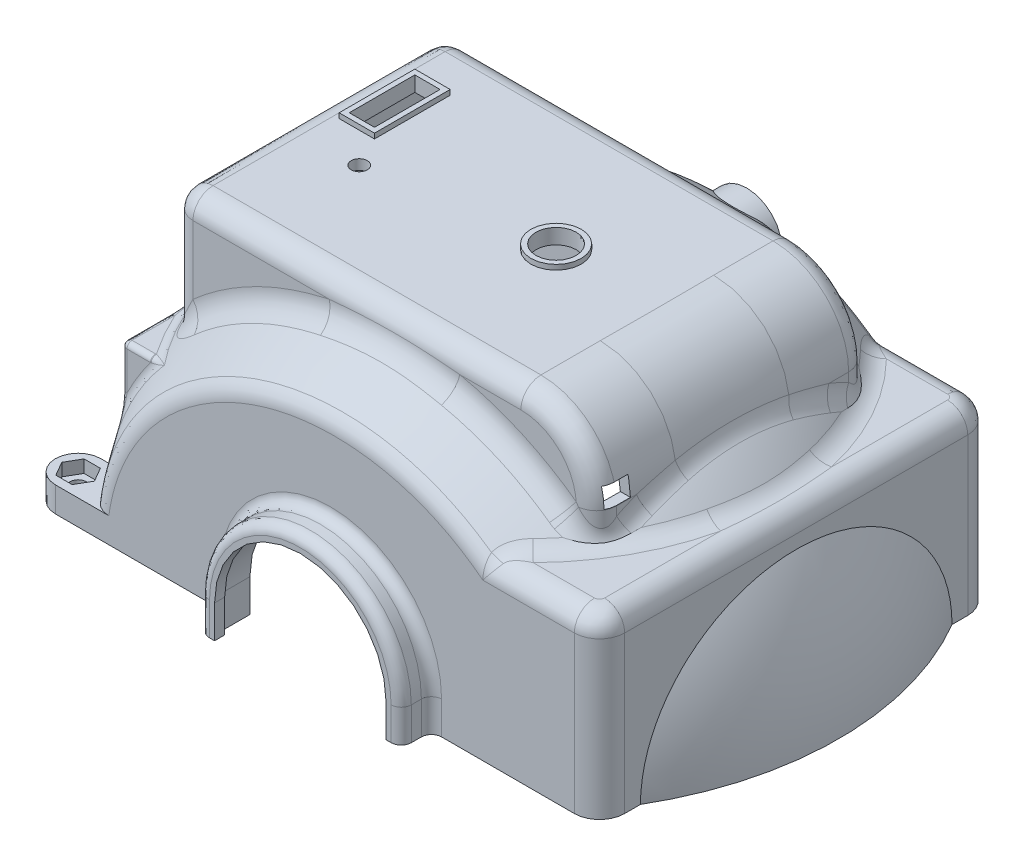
SolidWorks part; units mm, degrees
ref_plane "Plan de face" through (0, 0, 0) normal (0, 0, 1) x (1, 0, 0)
ref_plane "Plan de dessus" through (0, 0, 0) normal (0, 1, 0) x (1, 0, 0)
ref_plane "Plan de droite" through (0, 0, 0) normal (1, 0, 0) x (0, 0, -1)
sketch "Base" plane through (0, 0, 0) normal (0, 1, 0) x (1, 0, 0)
  line L0 (-52.1999, -39) -> (-25.6999, -39) construction
  line L1 (68.8001, 0) -> (-73.5868, 0) construction
  line L2 (-56.0925, -28.4341) -> (-46.1999, -20) construction
  line L3 (-19.6999, -33) -> (-19.6999, -29) construction
  line L4 (-19.6999, -29) -> (-13.8999, -29) construction
  line L5 (-9.8999, -25) -> (-9.8999, -24.5) construction
  line L6 (-9.8999, -24.5) -> (24.1001, -24.5) construction
  line L7 (24.1001, -24.5) -> (24.1001, -25) construction
  line L8 (28.1001, -29) -> (33.9001, -29) construction
  line L9 (33.9001, -29) -> (33.9001, -34) construction
  line L10 (38.9001, -39) -> (55.4001, -39) construction
  line L11 (60.4001, -34) -> (60.4001, -13.75) construction
  line L12 (57.9001, -11.25) -> (57.4001, -11.25) construction
  line L13 (57.9001, 11.25) -> (57.4001, 11.25) construction
  line L14 (60.4001, 34) -> (60.4001, 13.75) construction
  line L15 (38.9001, 39) -> (55.4001, 39) construction
  line L16 (33.9001, 29) -> (33.9001, 34) construction
  line L17 (28.1001, 29) -> (33.9001, 29) construction
  line L18 (24.1001, 24.5) -> (24.1001, 25) construction
  line L19 (-9.8999, 24.5) -> (24.1001, 24.5) construction
  line L20 (-9.8999, 25) -> (-9.8999, 24.5) construction
  line L21 (-19.6999, 29) -> (-13.8999, 29) construction
  line L22 (-19.6999, 33) -> (-19.6999, 29) construction
  line L23 (-56.0925, 28.4341) -> (-46.1999, 20) construction
  line L24 (-52.1999, 39) -> (-25.6999, 39) construction
  line L25 (57.4001, -11.25) -> (57.4001, 11.25) construction
  line L26 (-46.1999, -20) -> (-46.1999, 20) construction
  line L27 (57.4001, -66.5167) -> (57.4001, 25) construction
  line L28 (-46.1999, -66.5167) -> (-46.1999, 22.9924) construction
  line L29 (7.8001, -55.2275) -> (7.8001, 8.1549) construction
  line L30 (85.3932, 29) -> (-66.316, 29) construction
  line L31 (85.3932, -29) -> (-62.5031, -29) construction
  line L32 (39.9001, -34.5) -> (54.4001, -34.5) construction
  line L33 (-47.4499, -34.5) -> (-8.4415, -34.5) construction
  line L34 (-47.4499, 34.5) -> (-5.5388, 34.5) construction
  line L35 (-25.6999, -35.6222) -> (-25.6999, 43.8871) construction
  arc A0 (-56.0925, -28.4341) -> (-52.1999, -39) centre (-52.1999, -33) ccw construction
  arc A1 (60.4001, 13.75) -> (57.9001, 11.25) centre (57.9001, 13.75) cw construction
  arc A2 (-25.6999, -39) -> (-19.6999, -33) centre (-25.6999, -33) ccw construction
  arc A3 (-13.8999, -29) -> (-9.8999, -25) centre (-13.8999, -25) ccw construction
  arc A4 (24.1001, -25) -> (28.1001, -29) centre (28.1001, -25) ccw construction
  arc A5 (33.9001, -34) -> (38.9001, -39) centre (38.9001, -34) ccw construction
  arc A6 (55.4001, -39) -> (60.4001, -34) centre (55.4001, -34) ccw construction
  arc A7 (60.4001, -13.75) -> (57.9001, -11.25) centre (57.9001, -13.75) ccw construction
  arc A8 (38.9001, -39) -> (33.9001, -34) centre (38.9001, -34) cw construction
  arc A9 (55.4001, 39) -> (60.4001, 34) centre (55.4001, 34) cw construction
  arc A10 (24.1001, 25) -> (28.1001, 29) centre (28.1001, 25) cw construction
  arc A11 (-13.8999, 29) -> (-9.8999, 25) centre (-13.8999, 25) cw construction
  arc A12 (-25.6999, 39) -> (-19.6999, 33) centre (-25.6999, 33) cw construction
  arc A13 (-56.0925, 28.4341) -> (-52.1999, 39) centre (-52.1999, 33) cw construction
  circle A14 centre (-47.4499, -34.5) radius 1.6 construction
  circle A15 centre (-40.1999, -34.5) radius 1.6 construction
  circle A16 centre (-32.9499, -34.5) radius 1.6 construction
  circle A17 centre (-25.6999, -34.5) radius 1.6 construction
  circle A18 centre (-52.4499, -29.25) radius 1.6 construction
  circle A19 centre (-47.9499, -25.5) radius 1.6 construction
  circle A20 centre (39.9001, -34.5) radius 1.6 construction
  circle A21 centre (47.1501, -34.5) radius 1.6 construction
  circle A22 centre (54.4001, -34.5) radius 1.6 construction
  arc A23 (33.9001, 34) -> (38.9001, 39) centre (38.9001, 34) cw construction
  circle A24 centre (54.4001, 34.5) radius 1.6 construction
  circle A25 centre (47.1501, 34.5) radius 1.6 construction
  circle A26 centre (39.9001, 34.5) radius 1.6 construction
  circle A27 centre (-25.6999, 34.5) radius 1.6 construction
  circle A29 centre (-32.9499, 34.5) radius 1.6 construction
  circle A30 centre (-40.1999, 34.5) radius 1.6 construction
  circle A31 centre (-47.4499, 34.5) radius 1.6 construction
  circle A32 centre (-52.4499, 29.25) radius 1.6 construction
  circle A33 centre (-47.9499, 25.5) radius 1.6 construction
  circle A34 centre (7.8001, 0) radius 59 construction
  circle A35 centre (7.8001, 0) radius 61 construction
  dimension "D3" = 58
  dimension "D5" = 5.5
  dimension "D6" = 5
  dimension "D7" = 5.5
  dimension "D1" = 103.6
  dimension "D2" = 54
  dimension "D4" = 29
ref_plane "Plan1" through (0, 0, 0) normal (0, 0, 1) x (1, 0, 0)
sketch "Esquisse3" plane through (0, 0, 0) normal (0, 0, 1) x (1, 0, 0)
  line L0 (7.8001, -22.9267) -> (7.8001, 78.4642) construction
  line L1 (-76.3494, 0) -> (71.051, 0) construction
  line L2 (68.8001, -22.9267) -> (68.8001, 68.62) construction
  line L4 (68.8001, 0) -> (-73.5868, 0) construction
  line L5 (-76.3494, 56) -> (34.0829, 56) construction
  line L7 (7.8001, 56) -> (7.8001, 0)
  line L8 (7.8001, 0) -> (68.8001, 0)
  ellipse E0 centre (7.8001, 0) end of major axis (68.8001, 0) minor radius 56 (68.8001, 0) -> (7.8001, 56) ccw
  dimension "D1" = 61
  dimension "D2" = 56
revolve "Révolution2" add sketch "Esquisse3" angle 360 about L0
sketch "Esquisse6" plane through (0, 0, 0) normal (0, 1, 0) x (1, 0, 0)
  line L0 (72.3863, -39) -> (30.8766, -39) construction
  line L1 (70.9993, 39) -> (29.2915, 39) construction
  line L2 (81.0853, 29) -> (16.4096, 29) construction
  line L3 (85.3932, 29) -> (-66.316, 29) construction
  line L4 (81.0853, 31) -> (16.4096, 31) construction
  line L5 (60.4001, -45.401) -> (60.4001, 49.3084) construction
  line L8 (33.9001, 39) -> (55.4089, 39)
  line L9 (33.9001, 39) -> (33.9001, -39)
  line L10 (33.9001, -39) -> (55.4089, -39)
  line L11 (60.4089, 34) -> (60.4089, -34)
  arc A0 (55.4089, 39) -> (60.4089, 34) centre (55.4089, 34) cw
  arc A1 (55.4089, -39) -> (60.4089, -34) centre (55.4089, -34) ccw
  point P26 (60.4089, -39)
  dimension "D2" = 5
  dimension "D1" = 2
extrude "Boss.-Extru.3" add sketch "Esquisse6" along normal blind 35
sketch "Esquisse7" plane through (0, 0, 0) normal (0, 1, 0) x (1, 0, 0)
  line L2 (-63.3935, -39) -> (69.5123, -39) construction
  line L3 (69.5123, -45) -> (-63.3935, -45) construction
  line L4 (7.1001, -71.0684) -> (7.1001, -27.65) construction
  line L6 (-12.8999, -68.0931) -> (-12.8999, -34.0884) construction
  line L7 (-12.8999, -39) -> (-12.8999, -45)
  line L8 (27.1001, -39) -> (27.1001, -45)
  line L9 (27.1001, -45) -> (-12.8999, -45)
  line L10 (27.1001, -39) -> (54.7043, -39)
  line L11 (-12.8999, -39) -> (-39.104, -39)
  line L12 (70.5045, 0) -> (-19.9845, 0) construction
  line L13 (68.8001, 0) -> (-73.5868, 0) construction
  line L14 (27.1001, 39) -> (54.7043, 39)
  line L15 (-12.8999, 39) -> (-39.104, 39)
  line L16 (27.1001, 45) -> (-12.8999, 45)
  line L17 (-12.8999, 39) -> (-12.8999, 45)
  line L18 (27.1001, 39) -> (27.1001, 45)
  arc A0 (-39.104, -39) -> (54.7043, -39) centre (7.8001, 0) ccw
  arc A1 (-39.104, 39) -> (54.7043, 39) centre (7.8001, 0) cw
  dimension "D3" = 20
  dimension "D1" = 6
  dimension "D4" = 20
extrude "Enlèv. mat.-Extru.1" cut sketch "Esquisse7" along normal blind 45
sketch "Esquisse11" plane through (0, 0, 0) normal (0, 1, 0) x (1, 0, 0)
  line L0 (-77.6167, 0) -> (7.8001, 0) construction
  line L1 (68.8001, -74.0158) -> (68.8001, 13.4547) construction
  line L2 (-36.1999, -74.0158) -> (-36.1999, 32.9) construction
  line L3 (47.8001, -66.6109) -> (47.8001, 54.4132) construction
  line L4 (-86.41, -27) -> (47.8001, -27) construction
  line L5 (-86.41, 27) -> (55.4182, 27) construction
  line L7 (-36.1999, 27) -> (47.8001, 27)
  line L8 (-36.1999, 27) -> (-36.1999, -27)
  line L9 (-36.1999, -27) -> (47.8001, -27)
  line L10 (47.8001, 27) -> (47.8001, -27)
  dimension "D1" = 105
  dimension "D2" = 54
  dimension "D3" = 27
  dimension "D4" = 84
extrude "Boss.-Extru.5" add sketch "Esquisse11" along normal blind 56
sketch "Esquisse12" plane through (0, 0, -45) normal (0, 0, -1) x (-1, 0, 0)
  line L0 (15.0647, 6.5) -> (-34.5237, 6.5) construction
  line L1 (-7.1001, 10.3061) -> (-7.1001, -17.2144) construction
  line L2 (12.8999, -17.2144) -> (12.8999, 49.6212) construction
  line L3 (-27.1001, 0) -> (-27.1001, 50.5198) construction
  line L4 (-27.1001, 6.5) -> (-27.1001, 39.2453)
  line L5 (12.8999, 6.5) -> (12.8999, 38.6394)
  arc A0 (12.8999, 6.5) -> (-27.1001, 6.5) centre (-7.1001, 6.5) ccw
  arc A1 (12.8999, 38.6394) -> (-27.1001, 39.2453) centre (-7.7225, -2.141) ccw
extrude "Enlèv. mat.-Extru.2" cut sketch "Esquisse12" against normal blind 6
mirror "Symétrie2" about plane through (0, 0, 0) normal (0, 0, 1) of "Enlèv. mat.-Extru.2"
sketch "Esquisse29" plane through (0, 0, 0) normal (0, 0, 1) x (1, 0, 0)
  line L1 (-32.1667, 28.9128) -> (-41.7716, 28.9128)
  line L2 (-32.1667, 28.9128) -> (-32.1667, 15.2328)
  line L3 (-32.1667, 15.2328) -> (-41.7716, 15.2328)
  line L4 (-41.7716, 28.9128) -> (-41.7716, 15.2328)
extrude "Boss.-Extru.10" add sketch "Esquisse29" along normal mid plane 63
fillet "Congé5" radius 15 1 edges at (47.8001, 56, 0)
shell "Coque1" thickness 2
sketch "Esquisse13" plane through (-36.1999, 0, 0) normal (-1, 0, 0) x (0, 0, 1)
  line L0 (0, 63.7323) -> (0, -17.0662) construction
  line L1 (73.1741, 0) -> (-47.9571, 0) construction
  line L2 (61, 0) -> (-61, 0) construction
  line L3 (73.1741, 18) -> (-47.9571, 18) construction
  line L4 (30, -32.9065) -> (30, 20.2049) construction
  line L5 (-30, -32.9065) -> (-30, 20.2049) construction
  line L7 (-30, 0) -> (30, 0)
  line L8 (-30, 0) -> (-30, 13)
  line L9 (-25, 18) -> (25, 18)
  line L10 (30, 0) -> (30, 13)
  arc A0 (25, 18) -> (30, 13) centre (25, 13) cw
  arc A1 (-30, 13) -> (-25, 18) centre (-25, 13) cw
  point P19 (30, 18)
  dimension "D4" = 5
  dimension "D1" = 30
  dimension "D2" = 60
  dimension "D3" = 18
extrude "Enlèv. mat.-Extru.3" cut sketch "Esquisse13" along normal blind 18
sketch "Esquisse14" plane through (0, 0, 0) normal (0, -1, 0) x (1, 0, 0)
  line L0 (-79.4311, 0) -> (12.5412, 0) construction
  line L1 (68.8001, 0) -> (-73.5868, 0) construction
  line L2 (-47.4499, -42.7391) -> (-47.4499, -28.5073) construction
  line L3 (-47.4499, -39) -> (-36.4718, -39)
  line L5 (-47.4499, -30) -> (-43.0034, -30)
  line L6 (54.4001, -27.1233) -> (54.4001, -42.11) construction
  line L7 (59.3547, -34.5) -> (49.4924, -34.5) construction
  line L8 (50.9001, -30) -> (50.9001, -37.6623) construction
  line L9 (63.2235, -31) -> (49.4924, -31) construction
  line L10 (58.7435, -34) -> (58.7435, -31)
  line L11 (50.9001, -37.3434) -> (50.9001, -34.5)
  line L14 (55.4001, -37.3434) -> (50.9001, -37.3434)
  line L15 (-47.4499, 30) -> (-43.0034, 30)
  line L16 (-47.4499, 39) -> (-36.4718, 39)
  line L18 (54.4001, -31) -> (58.7435, -31)
  line L19 (54.4001, 31) -> (58.7435, 31)
  line L20 (55.4001, 37.3434) -> (50.9001, 37.3434)
  line L21 (50.9001, 37.3434) -> (50.9001, 34.5)
  line L22 (58.7435, 34) -> (58.7435, 31)
  circle A0 centre (-47.4499, -34.5) radius 1.6
  arc A1 (-47.4499, -30) -> (-47.4499, -39) centre (-47.4499, -34.5) ccw
  arc A2 (-43.0034, -30) -> (-36.4718, -39) centre (7.8001, 0) ccw
  circle A3 centre (54.4001, -34.5) radius 1.2
  arc A4 (54.4001, -31) -> (50.9001, -34.5) centre (54.4001, -34.5) ccw
  circle A5 centre (-47.4499, 34.5) radius 1.6
  arc A6 (55.4001, -37.3434) -> (58.7435, -34) centre (55.4001, -34) ccw
  arc A7 (-47.4499, 30) -> (-47.4499, 39) centre (-47.4499, 34.5) cw
  arc A8 (-43.0034, 30) -> (-36.4718, 39) centre (7.8001, 0) cw
  arc A9 (55.4001, 37.3434) -> (58.7435, 34) centre (55.4001, 34) cw
  arc A10 (54.4001, 31) -> (50.9001, 34.5) centre (54.4001, 34.5) cw
  circle A11 centre (54.4001, 34.5) radius 1.2
  dimension "D1" = 3.5
extrude "Boss.-Extru.6" add sketch "Esquisse14" against normal blind 5
sketch "Esquisse15" plane through (0, 5, 0) normal (0, 1, 0) x (1, 0, 0)
  line L0 (-60.7959, 0) -> (-39.9089, 0) construction
  line L1 (68.8001, 0) -> (-73.5868, 0) construction
  line L2 (-56.1694, 34.5) -> (-43.3787, 34.5) construction
  line L3 (-47.4499, 34.5) -> (-5.5388, 34.5) construction
  line L4 (-45.8333, -31.7) -> (-44.2167, -34.5)
  line L5 (-44.2167, 34.5) -> (-45.8333, 37.3)
  line L6 (-45.8333, 37.3) -> (-49.0664, 37.3)
  line L7 (-49.0664, 37.3) -> (-50.683, 34.5)
  line L8 (-50.683, 34.5) -> (-49.0664, 31.7)
  line L9 (-49.0664, 31.7) -> (-45.8333, 31.7)
  line L10 (-45.8333, 31.7) -> (-44.2167, 34.5)
  line L11 (-49.0664, -31.7) -> (-45.8333, -31.7)
  line L12 (-50.683, -34.5) -> (-49.0664, -31.7)
  line L13 (-49.0664, -37.3) -> (-50.683, -34.5)
  line L14 (-45.8333, -37.3) -> (-49.0664, -37.3)
  line L15 (-44.2167, -34.5) -> (-45.8333, -37.3)
  circle A0 centre (-47.4499, 34.5) radius 2.8 construction
  circle A1 centre (-47.4499, -34.5) radius 2.8 construction
extrude "Enlèv. mat.-Extru.4" cut sketch "Esquisse15" against normal blind 2.5
sketch "Esquisse16" plane through (0, 0, -45) normal (0, 0, -1) x (-1, 0, 0)
  line L0 (18.5881, 6.5) -> (-29.2197, 6.5) construction
  line L1 (18.5881, 0) -> (-29.2197, 0) construction
  line L2 (53.1999, 0) -> (-68.8001, 0) construction
  line L3 (9.8999, 6.5) -> (9.8999, 0)
  line L4 (9.8999, 0) -> (-24.1001, 0)
  line L5 (-24.1001, 0) -> (-24.1001, 6.5)
  arc A0 (9.8999, 6.5) -> (-24.1001, 6.5) centre (-7.1001, 6.5) ccw
extrude "Enlèv. mat.-Extru.5" cut sketch "Esquisse16" against normal through all
sketch "Esquisse17" plane through (0, 0, -37) normal (0, 0, 1) x (1, 0, 0)
  line L0 (10.6473, 38.5) -> (10.6411, 38.5) construction
  circle A0 centre (10.6009, 38.5) radius 5.5
extrude "Enlèv. mat.-Extru.6" cut sketch "Esquisse17" against normal mid plane 6
sketch "Esquisse18" plane through (0, 0, -37) normal (0, 0, 1) x (1, 0, 0)
  circle A0 centre (10.6009, 38.5) radius 5.5
  circle A1 centre (10.6009, 38.5) radius 7
extrude "Boss.-Extru.7" add sketch "Esquisse18" along normal mid plane 6
sketch "Esquisse20" plane through (-36.1999, 0, 0) normal (-1, 0, 0) x (0, 0, 1)
  line L0 (40.2482, 56) -> (-30.5902, 56) construction
  line L1 (40.2482, 47.15) -> (-5.4759, 47.15) construction
  line L2 (5.0181, 64.352) -> (5.0181, 42.3512) construction
  line L3 (-27, 64.352) -> (-27, 41.4093) construction
  circle A0 centre (5.0181, 47.15) radius 1.6
  dimension "D1" = 32.0181
  dimension "D2" = 8.85
sketch "Esquisse21" plane through (0, 56, 0) normal (0, 1, 0) x (1, 0, 0)
  line L0 (-50.8173, 27) -> (7.4821, 27) construction
  line L1 (-39.7293, -5.0181) -> (-11.6381, -5.0181) construction
  line L2 (-36.1999, -46.6388) -> (-36.1999, 29.3851) construction
  line L3 (-21.1999, -46.6569) -> (-21.1999, 4.1998) construction
  line L5 (32.8001, 27) -> (-36.1999, 27) construction
  circle A0 centre (-21.1999, -5.0181) radius 1.6
  dimension "D1" = 32.0181
  dimension "D2" = 15
extrude "Enlèv. mat.-Extru.7" cut sketch "Esquisse21" against normal blind 2
fillet "Congé6" radius 4 17 edges at (45.2654, 35, 39) (58.9444, 35, 37.5355) (60.4089, 35, 0) (58.9444, 35, -37.5355) (47.8001, 38, 27) (43.4067, 51.6066, 27) (47.8001, 38, -27) (43.4067, 51.6066, -27) (-12.8999, 38.6394, 39) (-12.8999, 38.6394, -39) (27.1001, 39.2453, -39) (45.2654, 35, -39) (-1.6999, 56, 27) (-36.1999, 42.9163, 27) (-1.6999, 56, -27) (-36.1999, 42.9163, -27) (-36.1999, 56, 0)
extrude "Enlèv. mat.-Extru.8" cut sketch "Esquisse20" against normal blind 2
sketch "Esquisse22" plane through (0, 56, 0) normal (0, 1, 0) x (1, 0, 0)
  line L0 (-36.1999, 23) -> (-36.1999, -23) construction
  line L1 (-25.1999, 15) -> (-30.1999, 15)
  line L2 (-25.1999, 15) -> (-25.1999, 2)
  line L3 (-25.1999, 2) -> (-30.1999, 2)
  line L4 (-30.1999, 15) -> (-30.1999, 2)
  line L5 (43.8001, 27) -> (-32.1999, 27) construction
  dimension "D1" = 6
  dimension "D2" = 12
  dimension "D3" = 13
  dimension "D4" = 5
extrude "Enlèv. mat.-Extru.9" cut sketch "Esquisse22" against normal blind 2
sketch "Esquisse23" plane through (0, 56, 0) normal (0, 1, 0) x (1, 0, 0)
  line L1 (-30.1999, 15) -> (-25.1999, 15)
  line L2 (-30.1999, 15) -> (-30.1999, 2)
  line L3 (-30.1999, 2) -> (-25.1999, 2)
  line L4 (-25.1999, 15) -> (-25.1999, 2)
  line L5 (-31.1999, 16) -> (-24.1999, 16)
  line L6 (-31.1999, 16) -> (-31.1999, 1)
  line L7 (-31.1999, 1) -> (-24.1999, 1)
  line L8 (-24.1999, 16) -> (-24.1999, 1)
  dimension "D1" = 1
  dimension "D2" = 1
  dimension "D3" = 15
  dimension "D4" = 7
extrude "Boss.-Extru.8" add sketch "Esquisse23" along normal blind 1
ref_plane "Plan2" through (28.0307, 0, 0) normal (1, 0, 0) x (0, 0, -1)
sketch "Esquisse28" plane through (45.8001, 0, 0) normal (-1, 0, 0) x (0, 0, 1)
  line L1 (24.9674, 41.1045) -> (20.2587, 41.1045)
  line L2 (24.9674, 41.1045) -> (24.9674, 44.8391)
  line L3 (24.9674, 44.8391) -> (20.2587, 44.8391)
  line L4 (20.2587, 41.1045) -> (20.2587, 44.8391)
extrude "Enlèv. mat.-Extru.11" cut sketch "Esquisse28" against normal mid plane 20
fillet "Congé3" radius 2 33 edges at (-24.7979, 29.6459, -37) (45.8504, 33, -37) (57.5302, 33, -36.1213) (58.4089, 33, 0) (57.5302, 33, 36.1213) (45.8504, 33, 37) (27.1001, 3.25, 39) (-12.8999, 3.25, 39) (27.1001, 3.25, 45) (-12.8999, 3.25, 45) (27.1001, 3.25, -39) (-12.8999, 3.25, -39) (27.1001, 3.25, -45) (-12.8999, 3.25, -45) (-0.6999, 54, 25) (-34.1999, 54, 0) (-0.6999, 54, -25) (-19.1982, 34.0354, 37) (-41.7716, 24.0271, 24.0552) (-41.7716, 22.3312, -25.9217) (-38.4371, 28.9128, 24.3151) (-38.4371, 28.9128, -24.3151) (7.1001, 26.5, 39) (7.1001, 26.5, 45) (7.1001, 26.5, -39) (7.1001, 26.5, -45) (45.8001, 37.6947, 25) (41.9925, 50.1924, 25) (45.8001, 37.6947, -25) (41.9925, 50.1924, -25)
fillet "Congé4" radius 1 18 edges at (-34.2295, 29.0348, 31.6606) (-41.9288, 13.7382, 32.0969) (-42.0768, 29.6464, 13.8338) (-34.2093, 29.0395, -31.666) (-41.9288, 13.7375, -32.097) (-41.9146, 29.3923, -15.2753) (-38.5533, 28.9128, 31.5) (-41.7716, 23.5409, 31.5) (-41.7716, 28.9128, 25.5527) (-38.5533, 28.9128, -31.5) (-41.7716, 23.5409, -31.5) (-41.7716, 28.9128, -25.5527)
fillet "Congé7" radius 5 15 edges at (-35.2187, 31.9836, -25.6242) (-36.1999, 38.7769, -0.9256) (-35.2805, 31.9626, 25.5514) (14.6173, 49.8241, 27) (46.6231, 36.1008, 25.8339) (47.1208, 36.0067, -25.23) (-5.8254, 48.6327, -27) (38.0468, 33.2453, -38.3104) (38.9819, 34.8157, -36.2001) (38.0453, 33.241, 38.3133) (38.6793, 34.6417, 36.6547) (55.4182, 35, 0)
ref_plane "Plan3" through (-50, 0, 0) normal (1, 0, 0) x (0, 0, -1)
sketch "Esquisse30" plane through (-50, 0, 0) normal (1, 0, 0) x (0, 0, -1)
  line L0 (0, -4.2097) -> (0, 31.1714) construction
  line L1 (-28.5355, 18) -> (12.9752, 18) construction
  line L2 (-25, 18) -> (25, 18) construction
  line L4 (11, 18) -> (-11, 18)
  line L5 (11, 18) -> (11, 28)
  line L6 (11, 28) -> (-11, 28)
  line L7 (-11, 18) -> (-11, 28)
  dimension "D1" = 11
extrude "Enlèv. mat.-Extru.12" cut sketch "Esquisse30" along normal blind 6
sketch "Esquisse31" plane through (0, 56, 0) normal (0, 1, 0) x (1, 0, 0)
  line L0 (25.8182, 0) -> (-7.1065, 0) construction
  line L1 (-36.1999, -42.9094) -> (-36.1999, 2.6372) construction
  line L2 (-36.1999, -23) -> (-36.1999, 23) construction
  line L3 (12.8001, -59.2528) -> (12.8001, 9.1391) construction
  circle A0 centre (12.8001, 0) radius 4
  dimension "D1" = 49
extrude "Enlèv. mat.-Extru.13" cut sketch "Esquisse31" against normal blind 2
sketch "Esquisse32" plane through (0, 56, 0) normal (0, 1, 0) x (1, 0, 0)
  circle A0 centre (12.8001, 0) radius 4
  circle A1 centre (12.8001, 0) radius 5
extrude "Boss.-Extru.11" add sketch "Esquisse32" along normal blind 1
